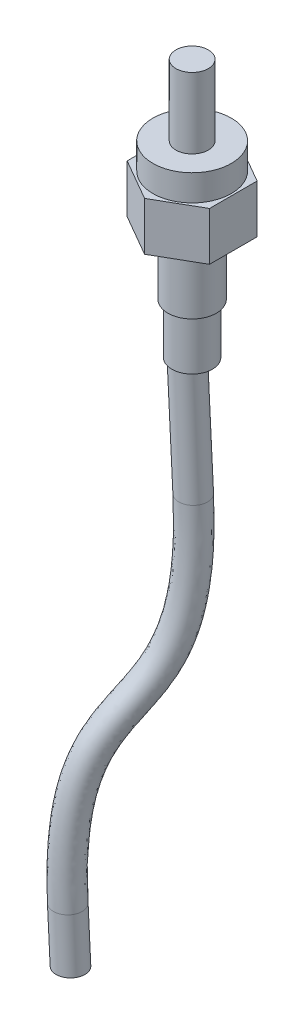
SolidWorks part; units mm, degrees
ref_plane "Front Plane" through (0, 0, 0) normal (0, 0, 1) x (1, 0, 0)
ref_plane "Top Plane" through (0, 0, 0) normal (0, 1, 0) x (1, 0, 0)
ref_plane "Right Plane" through (0, 0, 0) normal (1, 0, 0) x (0, 0, -1)
sketch "Sketch1" plane through (0, -151.1101, 0) normal (0, -1, 0) x (1, 0, 0)
  circle A1 centre (-97.3378, 7.6131) radius 1.397
sketch3d "3DSketch1"
  line L2 (-101.4616, -201.0085, 14.8298) -> (-101.6731, -195.7818, 14.8823)
  line L3 (-97.3378, -151.1101, 7.6131) -> (-96.872, -162.6251, 7.4974)
  spline S0 degree 3 poles (-96.872, -162.6251, 7.4974) (-95.9978, -184.2306, 7.2802) (-102.5285, -174.6397, 15.0948) (-101.6731, -195.7818, 14.8823) knots 0 0 0 0 1 1 1 1
  dimension "D1" = 9.8587
  dimension "D2" = 5.2313
  dimension "D3" = 11.525
  dimension "D4" = 34.3068
sweep "Sweep1" add profiles "Sketch1" path "3DSketch1"
sketch "Sketch2" plane through (0, -151.1101, 0) normal (0, 1, 0) x (1, 0, 0)
  circle A0 centre (-96.8635, -7.6131) radius 1.9719
  dimension "D1" = 3.9437
extrude "Extrude1" add sketch "Sketch2" along normal blind 4.9
sketch "Sketch3" plane through (0, -146.2101, 0) normal (0, 1, 0) x (1, 0, 0)
  circle A0 centre (-96.8635, -7.6131) radius 2.3495
  dimension "D1" = 4.699
extrude "Extrude2" add sketch "Sketch3" along normal blind 6.096
sketch "Sketch4" plane through (0, -140.1141, 0) normal (0, 1, 0) x (1, 0, 0)
  line L1 (-96.8635, -2.9937) -> (-100.864, -5.3034)
  line L2 (-100.864, -5.3034) -> (-100.864, -9.9228)
  line L3 (-100.864, -9.9228) -> (-96.8635, -12.2325)
  line L4 (-96.8635, -12.2325) -> (-92.863, -9.9228)
  line L5 (-92.863, -9.9228) -> (-92.863, -5.3034)
  line L6 (-92.863, -5.3034) -> (-96.8635, -2.9937)
  circle A0 centre (-96.8635, -7.6131) radius 4.0005 construction
  dimension "D1" = 8.001
extrude "Extrude3" add sketch "Sketch4" along normal blind 4.699
sketch "Sketch5" plane through (0, -135.4151, 0) normal (0, 1, 0) x (1, 0, 0)
  circle A0 centre (-96.8635, -7.6131) radius 3.81
  dimension "D1" = 7.62
extrude "Extrude4" add sketch "Sketch5" along normal blind 2.54
sketch "Sketch6" plane through (0, -132.8751, 0) normal (0, 1, 0) x (1, 0, 0)
  circle A0 centre (-96.8635, -7.6131) radius 1.5748
  dimension "D1" = 3.1496
extrude "Extrude5" add sketch "Sketch6" along normal blind 6.858
